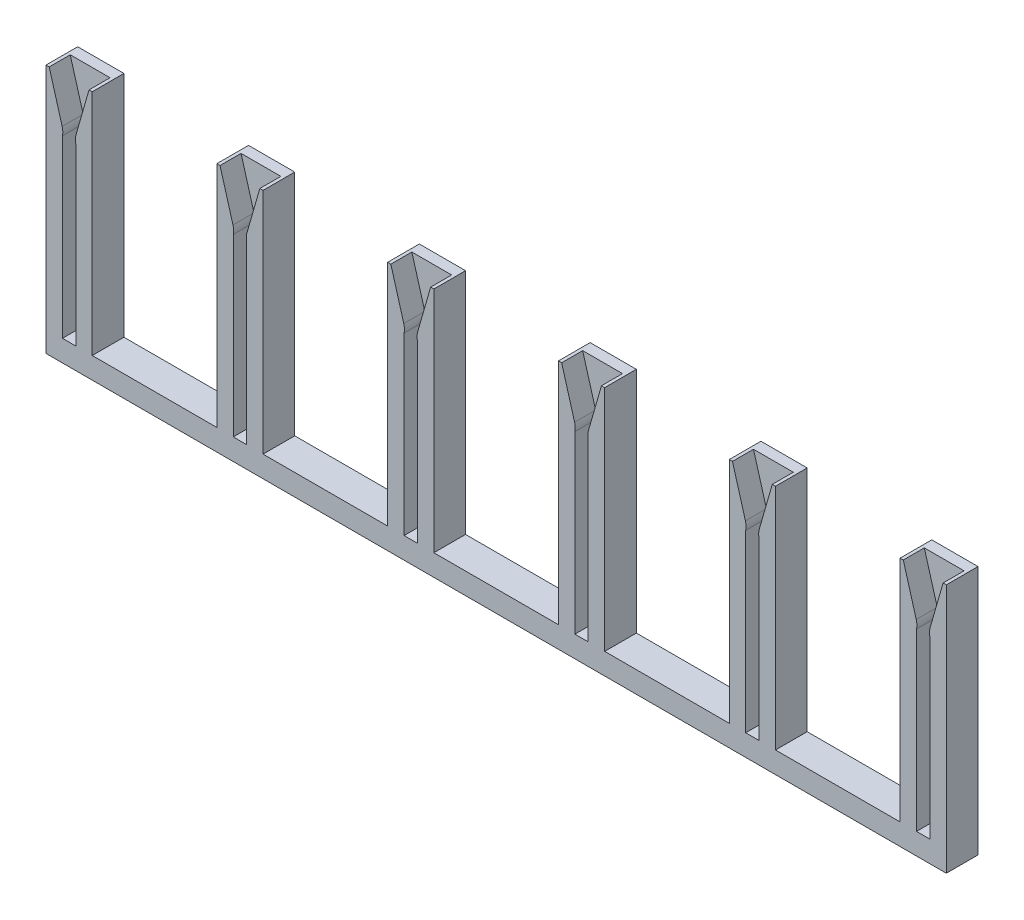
SolidWorks part; units mm, degrees
ref_plane "Front Plane" through (0, 0, 0) normal (0, 0, 1) x (1, 0, 0)
ref_plane "Top Plane" through (0, 0, 0) normal (0, 1, 0) x (1, 0, 0)
ref_plane "Right Plane" through (0, 0, 0) normal (1, 0, 0) x (0, 0, -1)
sketch "Sketch1" plane through (0, 0, 0) normal (0, 0, -1) x (-1, 0, 0)
  line L0 (17.57, 0) -> (17.57, 27.1756) construction
  line L1 (-2.75, 0) -> (-2.75, -2.54)
  line L2 (0, 0) -> (0, 32.4962) construction
  line L3 (0.7938, 0) -> (0.7938, 20.85)
  line L4 (2.369, 27.1756) -> (0.828, 21.819)
  line L5 (-2.75, 0) -> (-2.75, 27.1756)
  line L6 (-2.369, 27.1756) -> (-0.828, 21.819)
  line L7 (2.75, 0) -> (2.75, 27.1756)
  line L8 (19.5262, 0) -> (19.5262, 20.85) construction
  line L9 (2.75, 27.1756) -> (2.369, 27.1756)
  line L10 (-2.75, 27.1756) -> (-2.369, 27.1756)
  line L11 (-2.75, -2.54) -> (17.57, -2.54)
  line L12 (17.57, -2.54) -> (17.57, 0)
  line L13 (-0.7938, 0) -> (-0.7938, 20.85)
  line L14 (17.57, 0) -> (2.75, 0)
  line L15 (0.7938, 0) -> (-0.7938, 0)
  line L16 (20.32, 0) -> (20.32, 32.4962) construction
  arc A0 (0.828, 21.819) -> (0.7938, 20.85) centre (2.75, 21.266) ccw
  arc A3 (-0.828, 21.819) -> (-0.7938, 20.85) centre (-2.75, 21.266) cw
  dimension "D2" = 2
  dimension "D3" = 20.85
  dimension "D1" = 0.7938
  dimension "D4" = 0.381
  dimension "D5" = 16.05
  dimension "D6" = 1.9562
  dimension "D7" = 21.266
  dimension "D8" = 2.75
  dimension "D9" = 2.54
  dimension "D10" = 2
  dimension "D11" = 20.32
extrude "Boss-Extrude2" add sketch "Sketch1" along normal blind 2.5001
sketch "Sketch4" plane through (0, 0, -2.5001) normal (0, 0, -1) x (-1, 0, 0)
  line L40 (-2.75, 27.1756) -> (2.75, 27.1756)
  line L45 (2.75, 0) -> (2.75, 27.1756)
  line L46 (17.57, 0) -> (2.75, 0)
  line L47 (17.57, -2.54) -> (17.57, 0)
  line L48 (-2.75, -2.54) -> (17.57, -2.54)
  line L49 (-2.75, 27.1756) -> (-2.75, -2.54)
  line L50 (2.75, 0) -> (2.75, 27.1756)
  line L51 (17.57, 0) -> (2.75, 0)
  line L52 (17.57, -2.54) -> (17.57, 0)
  line L53 (-2.75, -2.54) -> (17.57, -2.54)
  line L54 (-2.75, 27.1756) -> (-2.75, -2.54)
  dimension "D1" = 0
extrude "Boss-Extrude3" add sketch "Sketch4" along normal blind 1.27
pattern_linear "LPattern1" count 6 spacing 20.32 along (-1, 0, 0) of "Boss-Extrude2", "Boss-Extrude3"
sketch "Sketch2" plane through (0, 0, -3.7701) normal (0, 0, -1) x (-1, 0, 0)
  line L1 (104.35, 0) -> (119.17, 0)
  line L2 (104.35, 0) -> (104.35, -2.54)
  line L3 (104.35, -2.54) -> (119.17, -2.54)
  line L4 (119.17, 0) -> (119.17, -2.54)
extrude "Cut-Extrude1" cut sketch "Sketch2" against normal through all and the other way through all
